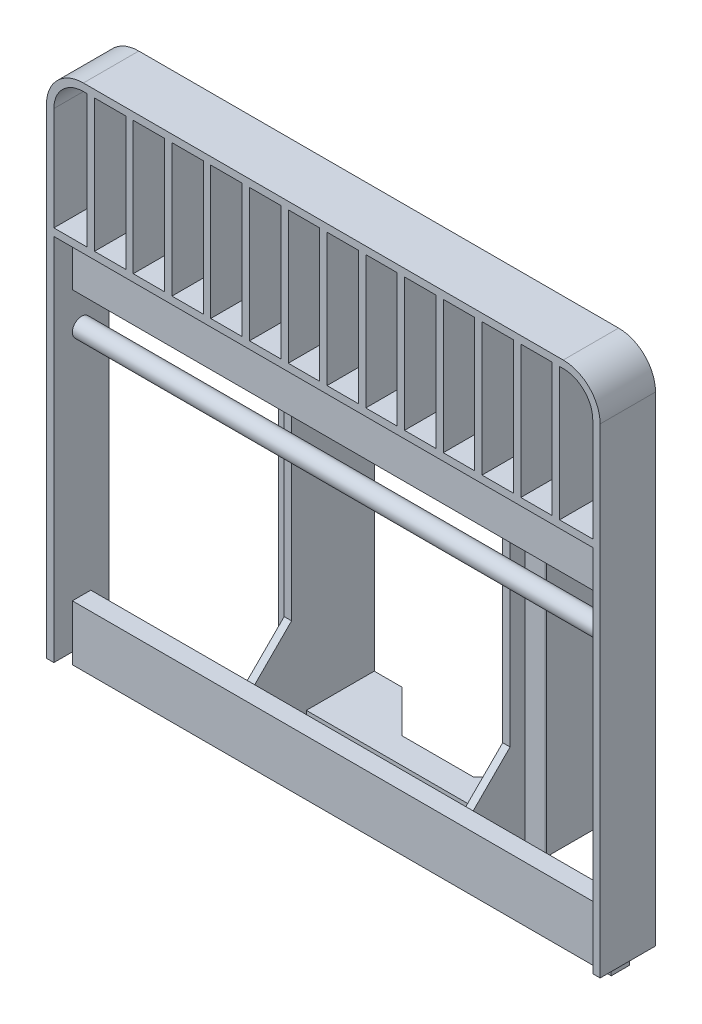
SolidWorks part; units mm, degrees
ref_plane "Front Plane" through (0, 0, 0) normal (0, 0, 1) x (1, 0, 0)
ref_plane "Top Plane" through (0, 0, 0) normal (0, 1, 0) x (1, 0, 0)
ref_plane "Right Plane" through (0, 0, 0) normal (1, 0, 0) x (0, 0, -1)
sketch "Sketch1" plane through (0, 0, 0) normal (0, 0, 1) x (1, 0, 0)
  line L0 (0, 0) -> (0, 1300)
  line L1 (100, 1400) -> (1400, 1400)
  line L2 (1500, 1300) -> (1500, 0)
  line L3 (20, 0) -> (20, 1300)
  line L4 (100, 1380) -> (1400, 1380)
  line L5 (1480, 1300) -> (1480, 0)
  line L6 (1480, 0) -> (1500, 0)
  line L7 (0, 0) -> (20, 0)
  line L9 (20, 1020) -> (1480, 1020)
  line L10 (20, 1020) -> (20, 1000)
  line L11 (20, 1000) -> (1480, 1000)
  line L12 (1480, 1020) -> (1480, 1000)
  arc A0 (1400, 1400) -> (1500, 1300) centre (1400, 1300) cw
  arc A1 (0, 1300) -> (100, 1400) centre (100, 1300) cw
  arc A2 (20, 1300) -> (100, 1380) centre (100, 1300) cw
  arc A3 (1400, 1380) -> (1480, 1300) centre (1400, 1300) cw
  point P7 (1500, 1400)
  point P10 (0, 1400)
  dimension "D3" = 100
  dimension "D1" = 1400
  dimension "D2" = 1500
  dimension "D5" = 20
  dimension "D6" = 1000
  dimension "D4" = 20
extrude "Boss-Extrude1" add sketch "Sketch1" along normal blind 150 contours L0 A1 L1 A0 L2 L6 L5 A3 L4 A2 L3 L7 | L11 L12 L9 L10
sketch "Sketch2" plane through (0, 0, 150) normal (0, 0, 1) x (1, 0, 0)
  line L0 (100, 1380) -> (1400, 1380) construction
  line L1 (740, 1380) -> (760, 1380)
  line L2 (740, 1380) -> (740, 1020)
  line L3 (740, 1020) -> (760, 1020)
  line L4 (760, 1380) -> (760, 1020)
  line L5 (20, 1020) -> (1480, 1020) construction
  line L6 (750, 1020) -> (750, 950.6064) construction
  line L7 (750, 1020) -> (750, 977.5403)
  dimension "D1" = 20
extrude "Boss-Extrude2" add sketch "Sketch2" against normal through all contours L4 L2 L3 M4 M1
pattern_linear "LPattern1" count 7 spacing 105 along (-1, 0, 0) count 7 spacing 105 along (1, 0, 0) of "Boss-Extrude2"
sketch "Sketch3" plane through (20, 0, 0) normal (1, 0, 0) x (0, 0, -1)
  line L0 (-150, 1000) -> (0, 1000) construction
  line L1 (-100, 120) -> (-50, 120)
  line L2 (-100, 120) -> (-100, -30)
  line L3 (-100, -30) -> (-50, -30)
  line L4 (-50, 120) -> (-50, -30)
  line L5 (-100, 1000) -> (-50, 1000)
  line L6 (-100, 1000) -> (-100, 850)
  line L7 (-100, 850) -> (-50, 850)
  line L8 (-50, 1000) -> (-50, 850)
  line L9 (-75, 850) -> (-75, 845.1647) construction
  line L10 (-75, 1000) -> (-75, 968.3395) construction
  line L11 (-150, 0) -> (0, 0) construction
  circle A0 centre (-75, 750) radius 25
  dimension "D4" = 50
  dimension "D1" = 50
  dimension "D2" = 150
  dimension "D3" = 30
  dimension "D5" = 100
extrude "Boss-Extrude3" add sketch "Sketch3" along normal up to vertex (1460 mm away)
sketch "Sketch5" plane through (0, 1000, 0) normal (0, -1, 0) x (1, 0, 0)
  line L0 (1036, 50) -> (1036, -274)
  line L1 (1480, 50) -> (20, 50) construction
  line L2 (1036, -274) -> (1113, -274)
  line L3 (1113, -274) -> (1113, -90)
  line L4 (1113, -90) -> (1056, -90)
  line L5 (1056, -90) -> (1056, 50)
  line L6 (1056, 50) -> (1036, 50)
  dimension "D1" = 20
  dimension "D2" = 57
  dimension "D3" = 184
  dimension "D4" = 140
extrude "Boss-Extrude10" add sketch "Sketch5" along normal up to vertex (1030 mm away) separate body contours L0 L2 L3 L4 L5 L6
sketch "Sketch6" plane through (1113, 0, 0) normal (1, 0, 0) x (0, 0, -1)
ref_plane "Plane1" through (750, 0, 0) normal (1, 0, 0) x (0, 0, -1)
mirror "Mirror25" about plane through (750, 0, 0) normal (1, 0, 0)
sketch "Sketch7" plane through (1056, 0, 0) normal (1, 0, 0) x (0, 0, -1)
  line L0 (-50, 850) -> (50, 750)
  line L1 (-50, -30) -> (-50, 1000) construction
  line L2 (50, 750) -> (50, 220)
  line L3 (50, 220) -> (-50, 120)
  line L4 (-50, 120) -> (-50, 850)
  line L5 (90, 1000) -> (-50, 1000) construction
  line L6 (90, -30) -> (-50, -30) construction
  dimension "D1" = 150
  dimension "D2" = 150
  dimension "D3" = 100
extrude "Cut-Extrude1" cut sketch "Sketch7" against normal blind 776
fillet "Fillet1" radius 2 2 edges at (1113, 485, -90) (1113, 485, -274)
fillet "Fillet2" radius 2 2 edges at (387, 485, -90) (387, 485, -274)
sketch "Sketch8" plane through (0, 1000, 0) normal (0, 1, 0) x (1, 0, 0)
  line L0 (1036, -50) -> (1036, 274) construction
  line L1 (464, 274) -> (539, 274)
  line L2 (464, 274) -> (464, 90)
  line L3 (464, 90) -> (1036, 90)
  line L4 (1036, 274) -> (1036, 90)
  line L5 (539, 274) -> (653, 160)
  line L6 (653, 160) -> (847, 160)
  line L7 (847, 160) -> (961, 274)
  line L8 (961, 274) -> (1036, 274)
  dimension "D1" = 70
  dimension "D2" = 75
  dimension "D3" = 135
extrude "Boss-Extrude44" add sketch "Sketch8" against normal blind 20
ref_plane "Plane2" through (0, 485, 0) normal (0, -1, 0) x (-1, 0, 0)
mirror "Mirror26" about plane through (0, 485, 0) normal (0, -1, 0) of "Boss-Extrude44"
